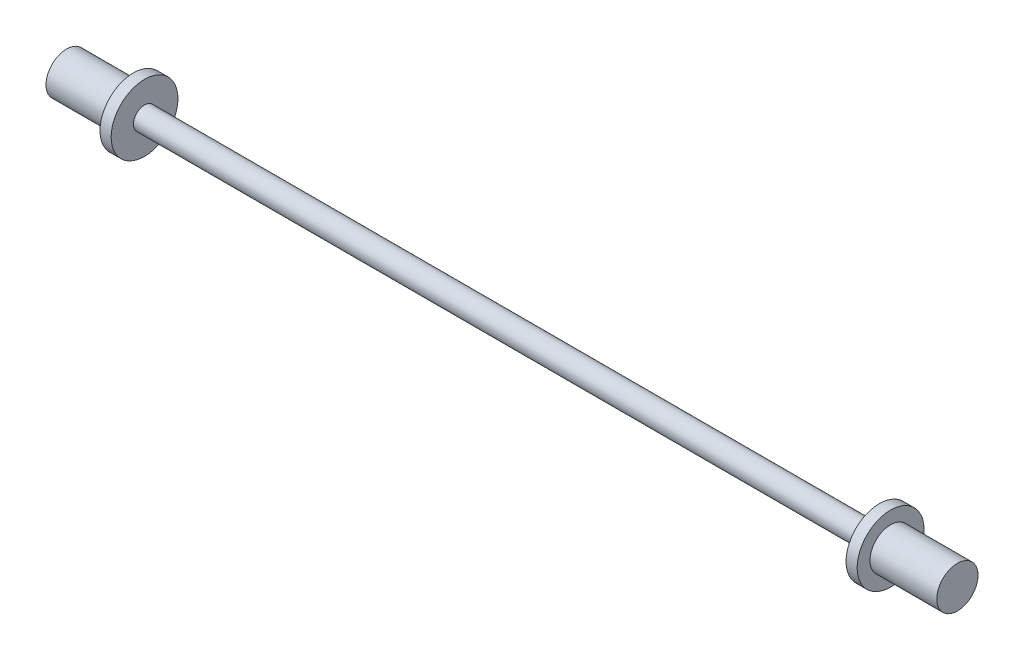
SolidWorks part; units mm, degrees
ref_plane "Front Plane" through (0, 0, 0) normal (0, 0, 1) x (1, 0, 0)
ref_plane "Top Plane" through (0, 0, 0) normal (0, 1, 0) x (1, 0, 0)
ref_plane "Right Plane" through (0, 0, 0) normal (1, 0, 0) x (0, 0, -1)
sketch "Sketch2" plane through (0, 0, 0) normal (1, 0, 0) x (0, 0, -1)
  circle A0 centre (0, 0) radius 6.35
  dimension "D1" = 12.7
extrude "Boss-Extrude1" add sketch "Sketch2" along normal blind 247.65 and the other way blind 171.45
sketch "Sketch3" plane through (247.65, 0, 0) normal (1, 0, 0) x (0, 0, -1)
  circle A0 centre (0, 0) radius 19.05
  dimension "D1" = 38.1
extrude "Boss-Extrude2" add sketch "Sketch3" along normal blind 6.35
sketch "Sketch7" plane through (-171.45, 0, 0) normal (-1, 0, 0) x (0, 0, 1)
  circle A0 centre (0, 0) radius 19.05 construction
  circle A3 centre (0, 0) radius 19.05
extrude "Boss-Extrude4" add sketch "Sketch7" along normal blind 6.35
sketch "Sketch9" plane through (-177.8, 0, 0) normal (-1, 0, 0) x (0, 0, 1)
  circle A0 centre (0, 0) radius 11.77
  dimension "D1" = 23.54
extrude "Boss-Extrude6" add sketch "Sketch9" along normal blind 38.1
sketch "Sketch10" plane through (254, 0, 0) normal (1, 0, 0) x (0, 0, -1)
  circle A0 centre (0, 0) radius 11.77 construction
  circle A1 centre (0, 0) radius 11.77
extrude "Boss-Extrude7" add sketch "Sketch10" along normal blind 38.1
